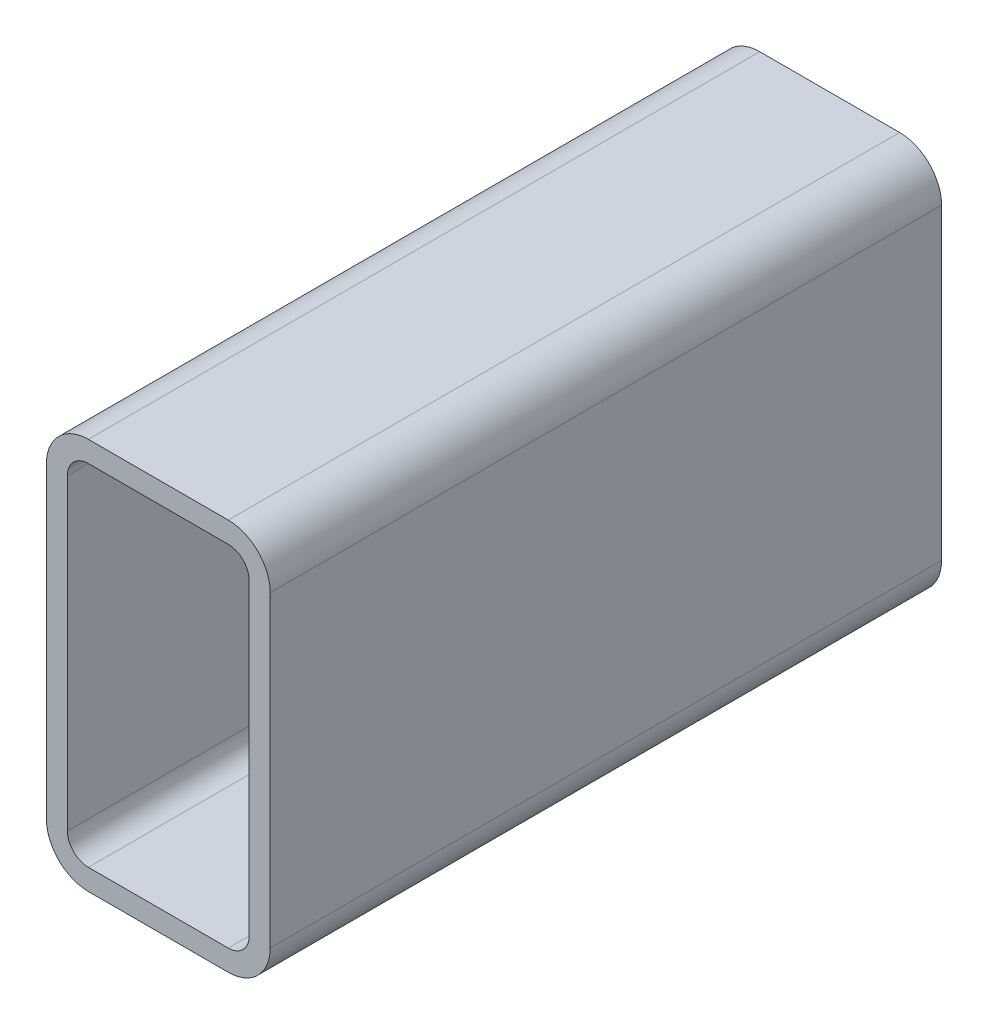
SolidWorks part; units mm, degrees
ref_plane "Front Plane" through (0, 0, 0) normal (0, 0, 1) x (1, 0, 0)
ref_plane "Top Plane" through (0, 0, 0) normal (0, 1, 0) x (1, 0, 0)
ref_plane "Right Plane" through (0, 0, 0) normal (1, 0, 0) x (0, 0, -1)
sketch "Sketch1" plane through (0, 0, 0) normal (0, 0, 1) x (1, 0, 0)
sketch_block_instance "HSS7x4x0.375-1"
sketch_block "HSS7x4x0.375"
extrude "Boss-Extrude1" add sketch "Sketch1" along normal blind 304.8
